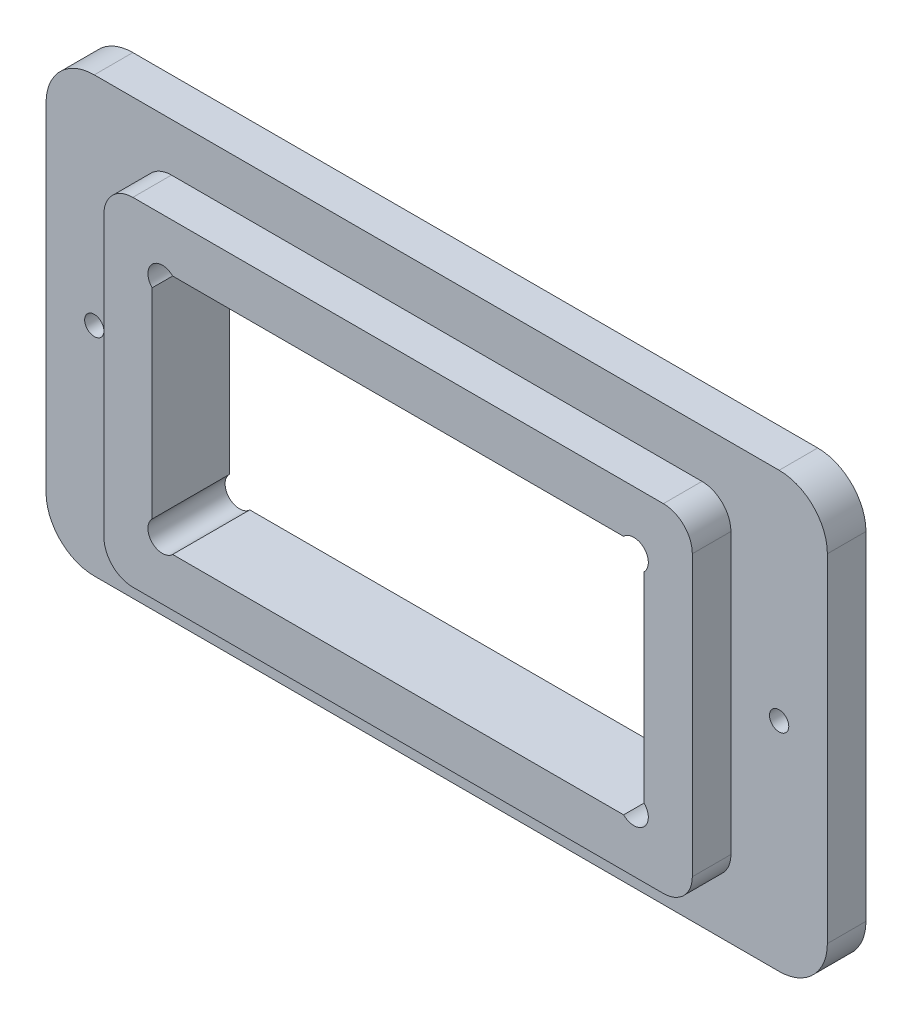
SolidWorks part; units mm, degrees
ref_plane "Plan de face" through (0, 0, 0) normal (0, 0, 1) x (1, 0, 0)
ref_plane "Plan de dessus" through (0, 0, 0) normal (0, 1, 0) x (1, 0, 0)
ref_plane "Plan de droite" through (0, 0, 0) normal (1, 0, 0) x (0, 0, -1)
sketch "Esquisse1" plane through (0, 0, 0) normal (0, 0, 1) x (1, 0, 0)
  line L0 (-44.2517, 13.8315) -> (-38.1419, 7.7217) construction
  line L1 (-42.1303, 13.8315) -> (4.627, 13.8315)
  line L2 (-44.2517, 11.7102) -> (-44.2517, -9.0472)
  line L3 (-42.1303, -11.1685) -> (4.627, -11.1685)
  line L4 (6.7483, 11.7102) -> (6.7483, -9.0472)
  line L5 (-54.2517, 23.8315) -> (16.7483, 23.8315)
  line L6 (-59.2517, 18.8315) -> (-59.2517, -16.1685)
  line L7 (-54.2517, -21.1685) -> (16.7483, -21.1685)
  line L8 (21.7483, 18.8315) -> (21.7483, -16.1685)
  line L9 (6.7483, 13.8315) -> (1.2881, 8.3712) construction
  line L10 (6.7483, -11.1685) -> (1.6856, -6.1057) construction
  line L11 (-44.2517, -11.1685) -> (-39.4415, -6.3583) construction
  arc A0 (-59.2517, -16.1685) -> (-54.2517, -21.1685) centre (-54.2517, -16.1685) ccw
  arc A1 (16.7483, -21.1685) -> (21.7483, -16.1685) centre (16.7483, -16.1685) ccw
  arc A2 (16.7483, 23.8315) -> (21.7483, 18.8315) centre (16.7483, 18.8315) cw
  arc A3 (-54.2517, 23.8315) -> (-59.2517, 18.8315) centre (-54.2517, 18.8315) ccw
  arc A4 (-42.1303, 13.8315) -> (-44.2517, 11.7102) centre (-43.191, 12.7708) ccw
  arc A5 (6.7483, 11.7102) -> (4.627, 13.8315) centre (5.6877, 12.7708) ccw
  arc A6 (-44.2517, -9.0472) -> (-42.1303, -11.1685) centre (-43.191, -10.1078) ccw
  arc A7 (4.627, -11.1685) -> (6.7483, -9.0472) centre (5.6877, -10.1078) ccw
  point P10 (-59.2517, -21.1685)
  point P15 (21.7483, 23.8315)
  point P18 (-59.2517, 23.8315)
  dimension "D7" = 5
  dimension "D1" = 51
  dimension "D2" = 25
  dimension "D3" = 81
  dimension "D4" = 15
  dimension "D5" = 10
  dimension "D6" = 45
  dimension "D8" = 45
  dimension "D9" = 45
  dimension "D10" = 45
  dimension "D11" = 45
extrude "Boss.-Extru.1" add sketch "Esquisse1" along normal blind 8
sketch "Esquisse2" plane through (0, 0, 8) normal (0, 0, 1) x (1, 0, 0)
  line L0 (16.7483, 23.8315) -> (-54.2517, 23.8315) construction
  line L1 (-49.2517, 18.8315) -> (11.7483, 18.8315)
  line L2 (-49.2517, 18.8315) -> (-49.2517, -16.1685)
  line L3 (-49.2517, -16.1685) -> (11.7483, -16.1685)
  line L4 (11.7483, 18.8315) -> (11.7483, -16.1685)
  line L5 (21.7483, -16.1685) -> (21.7483, 18.8315) construction
  line L6 (-59.2517, 18.8315) -> (-59.2517, -16.1685) construction
  line L7 (-54.2517, -21.1685) -> (16.7483, -21.1685) construction
  dimension "D1" = 5
  dimension "D2" = 10
  dimension "D3" = 10
  dimension "D4" = 5
extrude "Enlèv. mat.-Extru.1" cut sketch "Esquisse2" against normal blind 4 flip side to cut
sketch "Esquisse3" plane through (0, 0, 4) normal (0, 0, 1) x (1, 0, 0)
  line L0 (-59.2517, 1.3315) -> (-49.2517, 1.3315) construction
  line L1 (-59.2517, 18.8315) -> (-59.2517, -16.1685) construction
  line L2 (-49.2517, 18.8315) -> (-49.2517, -16.1685) construction
  line L3 (11.7483, 1.3315) -> (21.7483, 1.3315) construction
  line L4 (11.7483, -16.1685) -> (11.7483, 18.8315) construction
  line L5 (21.7483, -16.1685) -> (21.7483, 18.8315) construction
  circle A0 centre (-54.2517, 1.3315) radius 1
  circle A1 centre (16.7483, 1.3315) radius 1
extrude "Enlèv. mat.-Extru.2" cut sketch "Esquisse3" against normal blind 10
fillet "Congé1" radius 3 4 edges at (-49.2517, 18.8315, 6) (-49.2517, -16.1685, 6) (11.7483, -16.1685, 6) (11.7483, 18.8315, 6)
